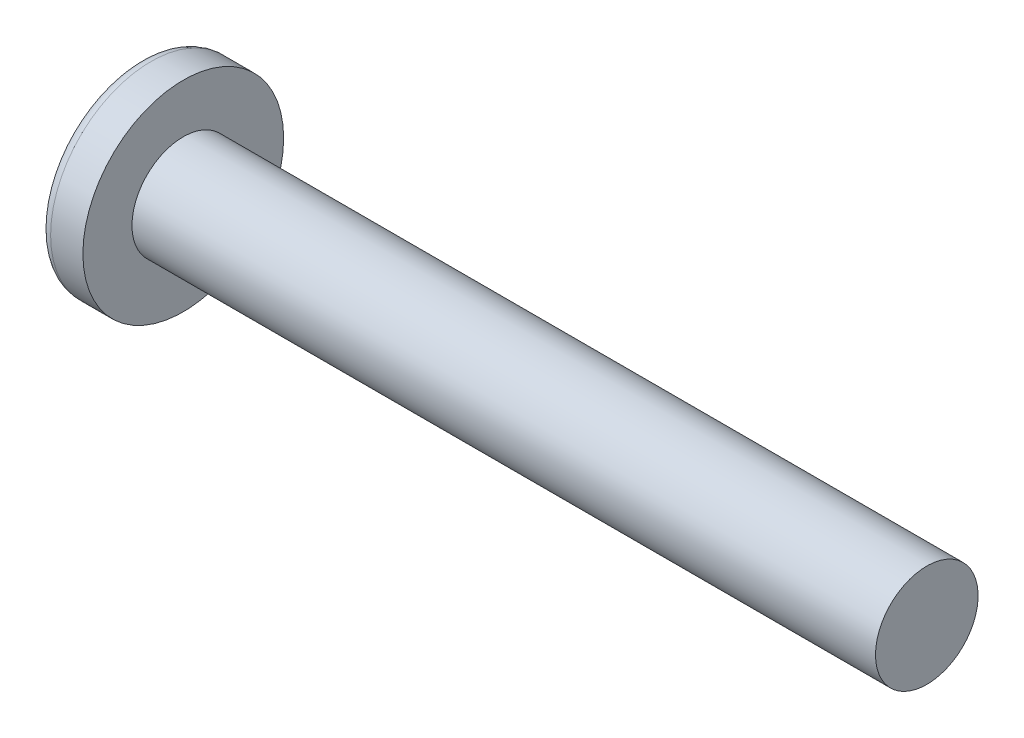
SolidWorks part; units mm, degrees
ref_plane "Plane1" through (0, 0, 0) normal (0, 0, 1) x (1, 0, 0)
ref_plane "Plane2" through (0, 0, 0) normal (0, 1, 0) x (1, 0, 0)
ref_plane "Plane3" through (0, 0, 0) normal (1, 0, 0) x (0, 0, -1)
sketch "BodySke" plane through (0, 0, 0) normal (0, 0, 1) x (1, 0, 0)
  line L0 (2.4638, 1.7526) -> (2.4638, 3.429)
  line L1 (2.86, 6.35) -> (2.86, -3.175) construction
  line L2 (-25.4, 0) -> (127, 0) construction
  line L3 (27.8638, 0) -> (0, 0)
  line L4 (2.4638, 1.7526) -> (27.8638, 1.7526)
  line L5 (27.8638, 1.7526) -> (27.8638, 0)
  line L6 (1.3616, 3.429) -> (2.4638, 3.429)
  line L7 (2.4638, -1.7526) -> (27.8638, -1.7526) construction
  line L8 (2.4638, 6.35) -> (2.4638, -3.175) construction
  arc A0 (1.0521, 3.2702) -> (0, 0) centre (5.6083, 0) ccw
  arc A2 (1.0521, 3.2702) -> (1.3616, 3.429) centre (1.3616, 3.048) cw
revolve "Base-Revolve" add sketch "BodySke" angle 360 about L2
sketch "Sketch3" plane through (0, 0, 0) normal (1, 0, 0) x (0, 0, -1)
  line L0 (0.4699, -2.2352) -> (-0.4699, -2.2352)
  line L1 (0.4699, -2.2352) -> (0.4699, 2.2352)
  line L2 (-0.4699, 2.2352) -> (0.4699, 2.2352)
  line L3 (-0.4699, 2.2352) -> (-0.4699, -2.2352)
ref_plane "Plane4" through (2.4384, 0, 0) normal (1, 0, 0) x (0, 0, -1)
sketch "Sketch4" plane through (2.4384, 0, 0) normal (1, 0, 0) x (0, 0, -1)
  line L0 (0.2349, -0.235) -> (-0.2349, -0.235)
  line L1 (0.2349, -0.235) -> (0.235, 0.2349)
  line L2 (-0.2349, 0.2349) -> (0.235, 0.2349)
  line L3 (-0.2349, 0.2349) -> (-0.2349, -0.235)
loft "Cut-Loft1" cut profiles "Sketch3", "Sketch4"
pattern_circular "CirPattern1" count 2 every 90 about axis through (0, 0, 0) along (1, 0, 0) of "Cut-Loft1"
sketch "ThdSchSke" plane through (0, 0, 0) normal (0, 0, 1) x (1, 0, 0)
  line L0 (3.2563, -1.2802) -> (2.9255, -1.7526)
  line L1 (3.2563, -1.2802) -> (3.5871, -1.7526)
  line L2 (3.5871, -1.7526) -> (3.5871, -2.1908)
  line L3 (-3.175, 0) -> (5.1513, 0) construction
  line L5 (3.5871, -2.1908) -> (2.9255, -2.1908)
  line L6 (2.9255, -2.1908) -> (2.9255, -1.7526)
revolve "ThreadSchematic" [suppressed] cut sketch "ThdSchSke" angle 360 about L3
pattern_linear "ThdSchPat" [suppressed]
equation "\"D1@Sketch3\" = \"Cross_dia@Sketch3\" / 2"
equation "\"D2@Sketch3\" = \"Cross_width@Sketch3\" / 2"
equation "\"D1@Sketch4\" = \"Cross_width@Sketch3\" *.5"
equation "\"D2@Sketch4\" = \"D1@Sketch4\""
equation "\"D3@Sketch4\" = \"D1@Sketch4\" / 2"
equation "\"D4@Sketch4\" = \"D2@Sketch4\" / 2"
equation "\"Thread_length@ThreadCosmetic\" = ((sgn( (\"Length@BodySke\" - \"Advance@BodySke\" ) - \"Thread_nom@BodySke\" )-1)*( (\"Length@BodySke\" - \"Advance@BodySke\" ) - \"Thread_nom@BodySke\" ))/-2+ \"Thread_nom@BodySke\""
equation "\"Thread_minor@ThdSchSke\" = \"Thread_minor@ThreadCosmetic\""
equation "\"Diameter@ThdSchSke\" = \"Diameter@BodySke\""
equation "\"Overcut@ThdSchSke\" = \"Diameter@BodySke\" * 1.25"
equation "\"Start@ThdSchSke\" = \"Head_ht@BodySke\" + \"Length@BodySke\" - \"Thread_length@ThreadCosmetic\"  '---Non-countersunk---"
equation "\"Num_threads@ThdSchPat\" = int( \"Thread_length@ThreadCosmetic\" / \"Advance@BodySke\" + 0.999 )  + 1"
equation "\"Advance@ThdSchPat\" = \"Thread_length@ThreadCosmetic\" /  (\"Num_threads@ThdSchPat\" - 1) 'relax it"
